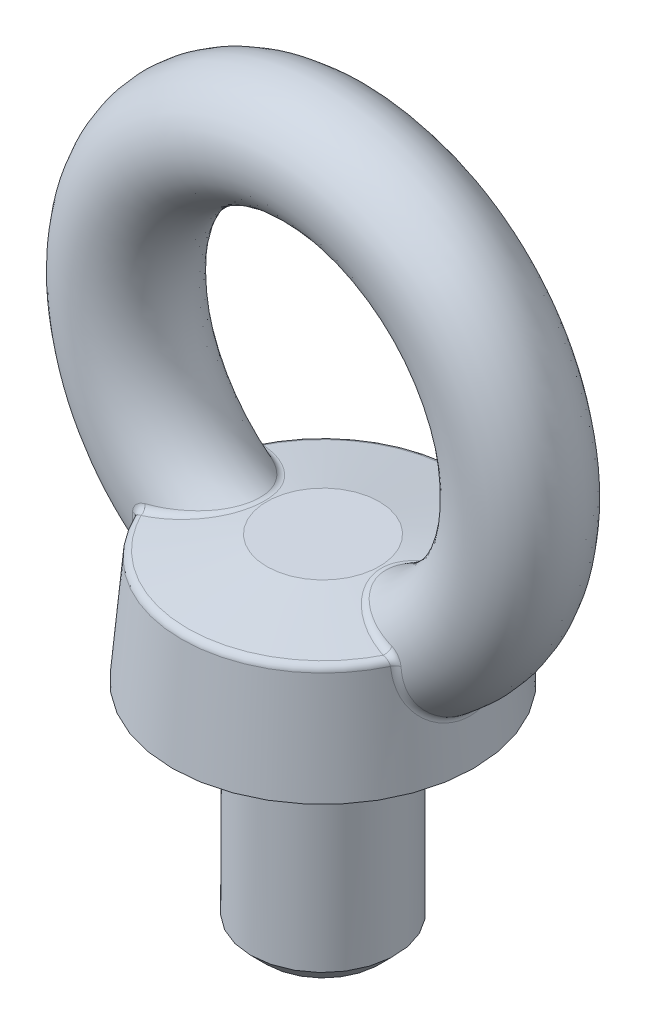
SolidWorks part; units mm, degrees
ref_plane "Front Plane" through (0, 0, 0) normal (0, 0, 1) x (1, 0, 0)
ref_plane "Top Plane" through (0, 0, 0) normal (0, 1, 0) x (1, 0, 0)
ref_plane "Right Plane" through (0, 0, 0) normal (1, 0, 0) x (0, 0, -1)
sketch "Sketch1" plane through (0, 0, 0) normal (0, 0, 1) x (1, 0, 0)
  ellipse E0 centre (0, 64) end of major axis (0, 0) minor radius 63
  dimension "D1" = 126
  dimension "D2" = 128
sketch "Sketch2" plane through (0, 0, 0) normal (1, 0, 0) x (0, 0, -1)
  line L3 (0, 128) -> (0, 0) construction
  circle A0 centre (0, 14) radius 14
  point P5 (0, 0)
sweep "Sweep1" add profiles "Sketch2" path "Sketch1"
sketch "Sketch3" plane through (0, 0, 0) normal (1, 0, 0) x (0, 0, -1)
  line L0 (0, 0) -> (-37.5, 0)
  line L1 (-37.5, 0) -> (-35.0503, 28)
  line L2 (-35.0503, 28) -> (-14, 31.7117)
  line L3 (-14, 31.7117) -> (0, 31.7117)
  line L4 (0, 31.7117) -> (0, 0)
revolve "Revolve1" add sketch "Sketch3" angle 360 about L4
fillet "Fillet1" radius 1.8 6 edges at (15.2589, 31.4709, -1.8116) (36.4662, 11.812, -0.1617) (-15.2589, 31.4709, 1.8116) (-36.4662, 11.812, 0.1617) (0, 28, -35.0503) (0, 28, 35.0503)
sketch "Sketch4" plane through (0, 0, 0) normal (0, -1, 0) x (1, 0, 0)
  circle A0 centre (0, 0) radius 18
  dimension "D1" = 36
extrude "Extrude1" add sketch "Sketch4" along normal blind 54
chamfer "Chamfer1" distance 4 angle 45 1 edges at (0, -54, -18)
sketch "Sketch5" plane through (0, 0, 0) normal (1, 0, 0) x (0, 0, -1)
  line L0 (-18, 0) -> (-18, -10.9282)
  line L1 (-18, 0) -> (-18, -50) construction
  line L2 (-14, -4) -> (-18, -10.9282)
  line L3 (-14, -4) -> (-14, -2)
  line L4 (-16, 0) -> (-18, 0)
  line L5 (-16, -2) -> (-14, -2) construction
  arc A1 (-14, -2) -> (-16, 0) centre (-16, -2) ccw
  point P0 (-14, -54)
  dimension "D1" = 30
revolve "Cut-Revolve1" cut sketch "Sketch5" angle 360 about axis through (0, -54, 0) along (0, 1, 0)
equation "\"D4@Sketch3\" = \"D1@Sketch2\""
equation "\"D5@Sketch3\" = \"D1@Sketch2\"/2"
